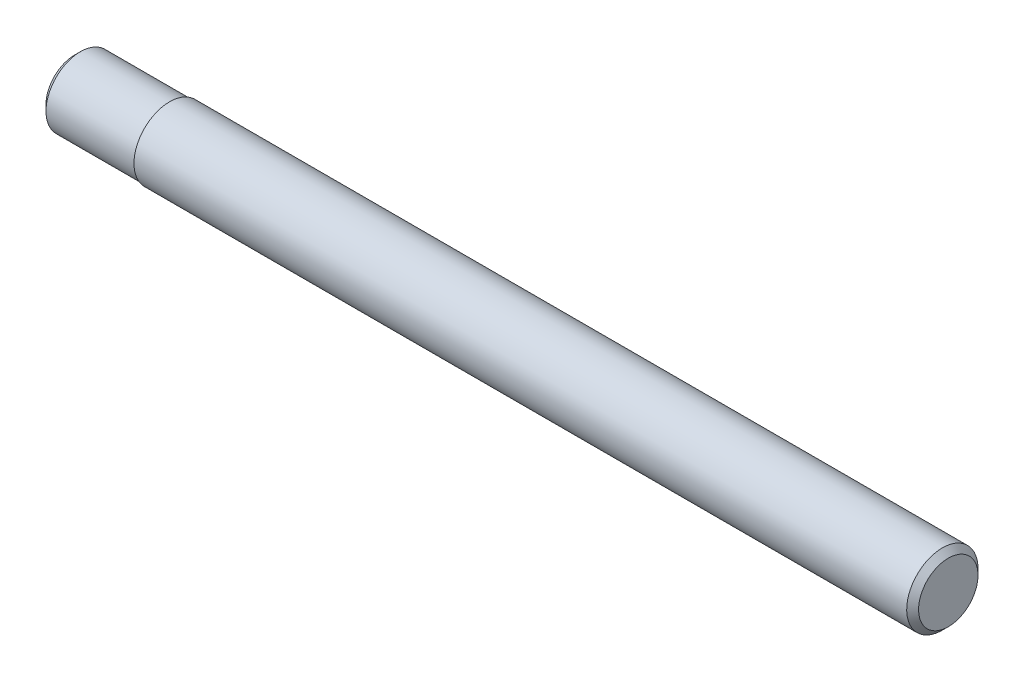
SolidWorks part; units mm, degrees
ref_plane "Plan de face" through (0, 0, 0) normal (0, 0, 1) x (1, 0, 0)
ref_plane "Plan de dessus" through (0, 0, 0) normal (0, 1, 0) x (1, 0, 0)
ref_plane "Plan de droite" through (0, 0, 0) normal (1, 0, 0) x (0, 0, -1)
sketch "Esquisse1" plane through (0, 0, 0) normal (0, 0, 1) x (1, 0, 0)
  line L0 (0, 0) -> (-40.5, 0)
  line L1 (-40.5, 2.9) -> (-40.5, 3)
  line L2 (-40.5, 3) -> (24.5, 3)
  line L16 (25, 2.5) -> (25, 0)
  line L17 (25, 0) -> (0, 0)
  line L18 (-40.5, 2.9) -> (-48, 2.9)
  line L19 (-48.5, 2.4) -> (-48.5, 0)
  line L20 (-48.5, 0) -> (-40.5, 0)
  line L21 (-48, 2.9) -> (-48.5, 2.4)
  line L22 (24.5, 3) -> (25, 2.5)
  point P16 (25, 3)
  point P20 (-48.5, 2.9)
  dimension "D2" = 25
revolve "Révolution1" add sketch "Esquisse1" angle 360 mid plane about L0
